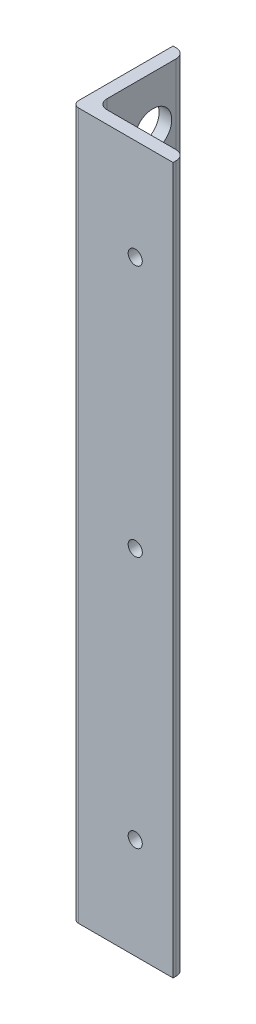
SolidWorks part; units mm, degrees
ref_plane "Front Plane" through (0, 0, 0) normal (0, 0, 1) x (1, 0, 0)
ref_plane "Top Plane" through (0, 0, 0) normal (0, 1, 0) x (1, 0, 0)
ref_plane "Right Plane" through (0, 0, 0) normal (1, 0, 0) x (0, 0, -1)
sketch "Sketch1" plane through (0, 0, 0) normal (0, 1, 0) x (1, 0, 0)
  line L0 (0, 0) -> (0, 25.4)
  line L1 (0, 25.4) -> (3.175, 25.4)
  line L2 (3.175, 25.4) -> (3.175, 3.175)
  line L3 (3.175, 3.175) -> (25.4, 3.175)
  line L4 (25.4, 3.175) -> (25.4, 0)
  line L5 (25.4, 0) -> (0, 0)
  dimension "D1" = 25.4
  dimension "D2" = 3.175
extrude "Boss-Extrude1" add sketch "Sketch1" along normal blind 177.8
fillet "Fillet1" radius 2.3813 3 edges at (3.175, 88.9, -3.175) (3.175, 88.9, -25.4) (25.4, 88.9, -3.175)
fillet "Fillet2" radius 1.5875 1 edges at (0, 88.9, 0)
sketch "Sketch3" plane through (3.175, 0, 0) normal (1, 0, 0) x (0, 0, -1)
  line L0 (17.145, 203.2) -> (17.145, 0) construction
  line L3 (0, 88.9) -> (25.4, 88.9) construction
  line L4 (0, 177.8) -> (0, 0) construction
  line L5 (25.4, 177.8) -> (25.4, 0) construction
  line L6 (5.5562, 0) -> (23.0187, 0) construction
  circle A0 centre (17.145, 165.1) radius 4.7371
  circle A1 centre (17.145, 114.3) radius 4.7371
  circle A2 centre (17.145, 12.7) radius 4.7371
  circle A3 centre (17.145, 63.5) radius 4.7371
  point P21 (17.145, 114.3)
  point P22 (17.145, 165.1)
  point P23 (17.145, 12.7)
  point P26 (17.145, 63.5)
  dimension "D1" = 9.4742
  dimension "D2" = 50.8
  dimension "D3" = 50.8
  dimension "D4" = 8.255
extrude "Cut-Extrude2" cut sketch "Sketch3" against normal through all
sketch "Sketch4" plane through (0, 0, -3.175) normal (0, 0, -1) x (-1, 0, 0)
  circle A12 centre (-15.875, 25.4) radius 1.778 construction
  circle A13 centre (-15.875, 88.9) radius 1.778 construction
  circle A14 centre (-15.875, 152.4) radius 1.778 construction
  circle A15 centre (-15.875, 25.4) radius 1.778
  circle A16 centre (-15.875, 88.9) radius 1.778
  circle A17 centre (-15.875, 152.4) radius 1.778
extrude "Cut-Extrude3" cut sketch "Sketch4" against normal through all
